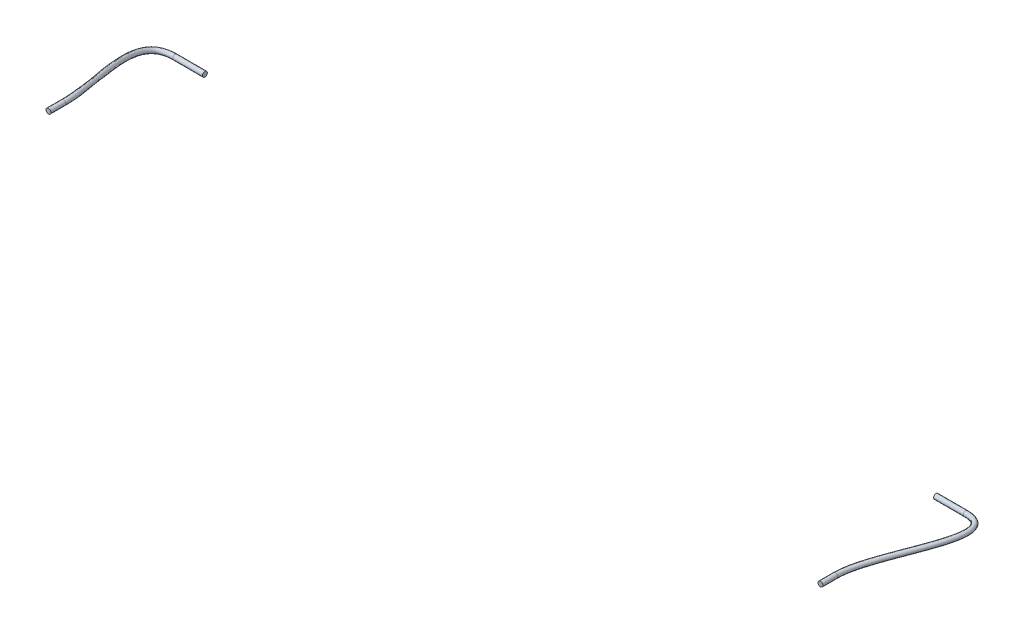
SolidWorks part; units mm, degrees
ref_plane "Front Plane" through (0, 0, 0) normal (0, 0, 1) x (1, 0, 0)
ref_plane "Top Plane" through (0, 0, 0) normal (0, 1, 0) x (1, 0, 0)
ref_plane "Right Plane" through (0, 0, 0) normal (1, 0, 0) x (0, 0, -1)
sketch3d "3DSketch1"
  line L0 (2.3158, 18.963, -11.6432) -> (-30.9582, 18.963, -11.6432) construction
  line L1 (-28.9175, 35.1192, 98.5293) -> (-28.9175, 35.1192, 85.8293) construction
  line L2 (-5.6003, 18.963, -11.6432) -> (-30.9582, 18.963, -11.6432)
  line L3 (-28.9175, 35.1192, 98.5293) -> (-28.9175, 35.1192, 85.8293)
  spline S0 degree 3 poles (-1629.6968, -497.2083, -983.3276) (1681.6334, 567.0091, 1527.8608) (-1756.7721, -442.0511, -1466.3622) (1553.7327, 368.7542, 1155.5014) knots -2.130272 -2.130272 -2.130272 -2.130272 2.808779 2.808779 2.808779 2.808779 only from (-28.9175, 35.1192, 85.8293) to (-30.9582, 18.963, -11.6432) construction
  spline S1 degree 3 poles (-28.9175, 35.1192, 85.8293) (-28.9175, 35.1192, 51.6165) (-66.9433, 18.963, -11.6432) (-30.9582, 18.963, -11.6432) knots 0 0 0 0 1 1 1 1
ref_plane "Plane1" through (-5.6003, 18.963, -11.6432) normal (-1, 0, 0) x (0, 0, 1)
sketch "PipeSketch" plane through (-5.6003, 18.963, -11.6432) normal (-1, 0, 0) x (0, 0, 1)
  circle A0 centre (0, 0) radius 2.0955
  dimension "OuterDiameter" = 4.191
sweep "Sweep1" add profiles "PipeSketch" path "3DSketch1"
sketch3d "3DSketch2"
  line L0 (610.3622, 18.963, -11.6432) -> (643.6362, 18.963, -11.6432) construction
  line L1 (634.4835, 19.6506, 103.2283) -> (634.4835, 19.6506, 90.5283) construction
  line L2 (618.2783, 18.963, -11.6432) -> (643.6362, 18.963, -11.6432)
  line L3 (634.4835, 19.6506, 103.2283) -> (634.4835, 19.6506, 90.5283)
  spline S0 degree 3 poles (2352.7141, -0.9243, -927.3037) (-1203.2675, 40.382, 1486.1458) (2477.6577, 0.9871, -1423.5342) (-1009.7036, 32.5078, 1112.372) knots -2.052241 -2.052241 -2.052241 -2.052241 2.742765 2.742765 2.742765 2.742765 only from (634.4835, 19.6506, 90.5283) to (643.6362, 18.963, -11.6432) construction
  spline S1 degree 3 poles (634.4835, 19.6506, 90.5283) (634.4835, 19.6506, 54.9733) (681.0887, 18.963, -11.6432) (643.6362, 18.963, -11.6432) knots 0 0 0 0 1 1 1 1
ref_plane "Plane2" through (618.2783, 18.963, -11.6432) normal (1, 0, 0) x (0, 0, -1)
sketch "Sketch2" plane through (618.2783, 18.963, -11.6432) normal (1, 0, 0) x (0, 0, -1)
  circle A0 centre (0, 0) radius 2.0955
  dimension "OuterDiameter" = 4.191
sweep "Sweep2" add profiles "Sketch2" path "3DSketch2"
